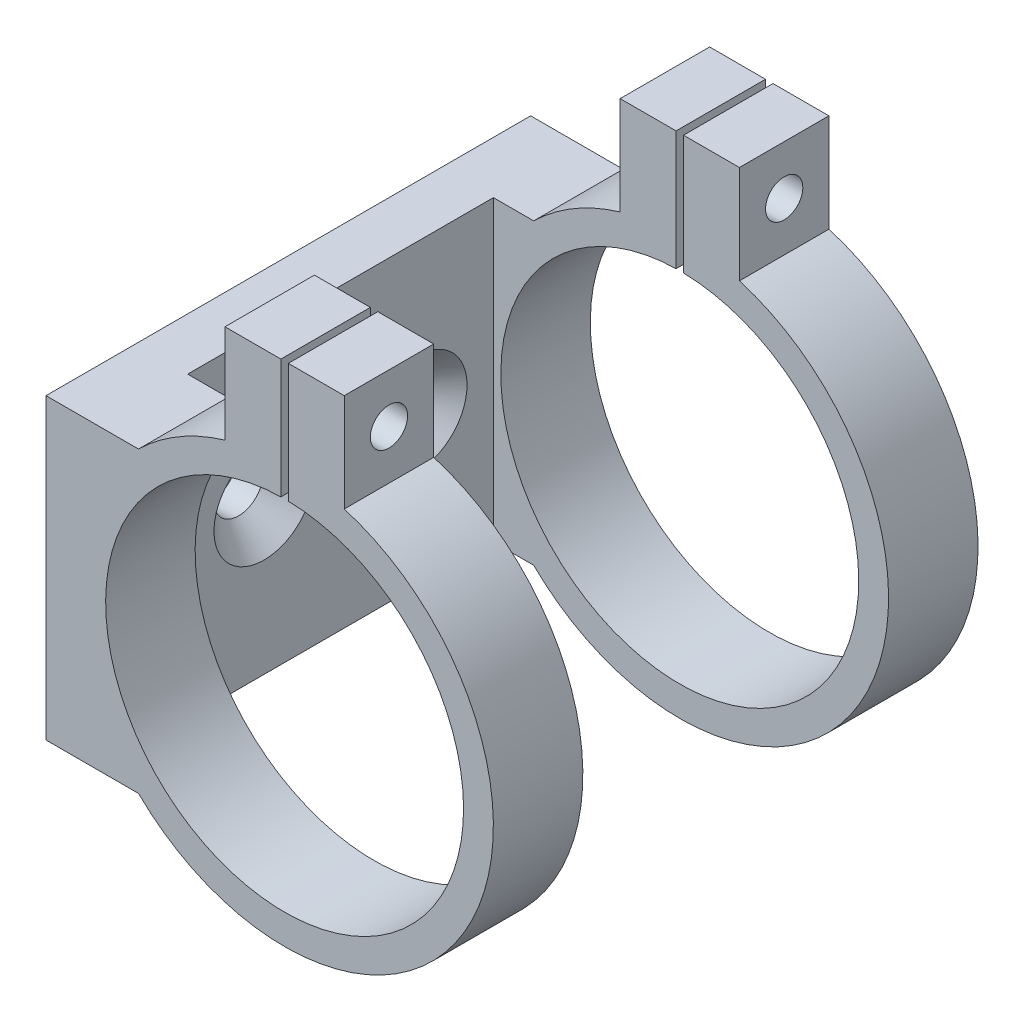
SolidWorks part; units mm, degrees
ref_plane "Front Plane" through (0, 0, 0) normal (0, 0, 1) x (1, 0, 0)
ref_plane "Top Plane" through (0, 0, 0) normal (0, 1, 0) x (1, 0, 0)
ref_plane "Right Plane" through (0, 0, 0) normal (1, 0, 0) x (0, 0, -1)
sketch "Sketch1" plane through (0, 0, 0) normal (0, 0, 1) x (1, 0, 0)
  line L0 (0, 0) -> (0, 56.8977) construction
  line L1 (8, 40) -> (-8, 40)
  line L2 (-8, 40) -> (-8, 26.8328)
  line L3 (8, 40) -> (8, 26.8328)
  line L4 (0, 0) -> (-62.8167, 0) construction
  line L5 (-32, -20) -> (-32, 20)
  line L6 (-32, 20) -> (-19.5959, 20)
  line L7 (-32, -20) -> (-19.5959, -20)
  line L8 (-53.7317, 28) -> (53.7317, 28) construction
  line L9 (-28, 33.8607) -> (-28, -33.8607) construction
  circle A0 centre (0, 0) radius 24
  circle A1 centre (0, 0) radius 28
  point P11 (0, 40)
  point P17 (-32, 0)
  point P21 (0, 28)
  point P23 (-28, 0)
  dimension "D2" = 48
  dimension "D5" = 4
  dimension "D3" = 8
  dimension "D4" = 12
  dimension "D6" = 40
  dimension "D1" = 4
extrude "Boss-Extrude1" add sketch "Sketch1" along normal mid plane 65 contours A1 L3 L1 L2 | A1 A0 | A1 L6 L5 | A1 L5 L7
ref_plane "Plane1" through (-25, 0, 0) normal (-1, 0, 0) x (0, 0, 1)
sketch "Sketch2" plane through (-25, 0, 0) normal (-1, 0, 0) x (0, 0, 1)
  line L0 (0, 60.0935) -> (0, -60.0935) construction
  line L1 (-20.5, 40) -> (-20.5, -28.6785)
  line L2 (32.5, 40) -> (-32.5, 40) construction
  line L3 (-20.5, -28.6785) -> (20.5, -28.6785)
  line L4 (20.5, -28.6785) -> (20.5, 40)
  line L5 (20.5, 40) -> (-20.5, 40)
  line L6 (-32.5, 40) -> (-32.5, 26.8328) construction
  line L7 (32.5, 40) -> (32.5, 26.8328) construction
  point P4 (0, 0)
  dimension "D1" = 12
  dimension "D2" = 12
extrude "Cut-Extrude1" cut sketch "Sketch2" against normal through all
sketch "Sketch3" plane through (0, 0, 32.5) normal (0, 0, 1) x (1, 0, 0)
  line L0 (0, 40) -> (0, 24) construction
  line L1 (8, 40) -> (-8, 40) construction
  line L3 (-0.5, 16.7683) -> (0.5, 16.7683)
  line L4 (-0.5, 16.7683) -> (-0.5, 47.2317)
  line L5 (-0.5, 47.2317) -> (0.5, 47.2317)
  line L6 (0.5, 16.7683) -> (0.5, 47.2317)
  line L7 (-0.5, 16.7683) -> (0.5, 47.2317) construction
  line L8 (-0.5, 47.2317) -> (0.5, 16.7683) construction
  circle A0 centre (0, 0) radius 24 construction
  point P7 (0, 32)
  dimension "D1" = 1
extrude "Cut-Extrude2" cut sketch "Sketch3" against normal up to surface (65 mm away)
sketch "Sketch4" plane through (8, 0, 0) normal (1, 0, 0) x (0, 0, -1)
  line L0 (20.5, 33.4164) -> (32.5, 33.4164) construction
  line L1 (20.5, 26.8328) -> (20.5, 40) construction
  line L2 (32.5, 40) -> (32.5, 26.8328) construction
  line L3 (-20.5, 33.4164) -> (-32.5, 33.4164) construction
  line L4 (-20.5, 40) -> (-20.5, 26.8328) construction
  line L5 (-32.5, 40) -> (-32.5, 26.8328) construction
  circle A0 centre (26.5, 33.4164) radius 2.5
  circle A1 centre (-26.5, 33.4164) radius 2.5
  dimension "D1" = 5
extrude "Cut-Extrude3" cut sketch "Sketch4" against normal up to surface (16 mm away)
sketch "Sketch8" plane through (-25, 0, 0) normal (1, 0, 0) x (0, 0, -1)
  line L0 (0, -20) -> (0, 20) construction
  line L1 (20.5, -20) -> (-20.5, -20) construction
  line L2 (20.5, 20) -> (-20.5, 20) construction
  line L3 (0, 0) -> (-20.5, 0) construction
  line L4 (-20.5, -20) -> (-20.5, 20) construction
  line L5 (0, 0) -> (20.5, 0) construction
  line L6 (20.5, 20) -> (20.5, -20) construction
  circle A0 centre (-10.25, 0) radius 2.9128 construction
  circle A1 centre (10.25, 0) radius 2.9128 construction
hole_wizard "CSK for M6 SFHCS1" positions "Sketch11" profile "Sketch12" countersink size "M6" standard "ANSI Metric"
sketch "Sketch11" plane through (-25, 0, 0) normal (1, 0, 0) x (0, 0, -1)
  point P0 (-10.25, 0)
  point P3 (10.25, 0)
sketch "Sketch12" plane through (-25, 0, 10.25) normal (0, 1, 0) x (0, 0, -1)
  line L0 (0, 0) -> (0, 7)
  line L1 (0, 7) -> (3.3, 7)
  line L2 (3.3, 7) -> (3.3, 3.42)
  line L3 (3.3, 3.42) -> (6.72, 0)
  line L5 (6.72, 0) -> (0, 0)
  line L6 (-3.3, 3.42) -> (-6.72, 0) construction
  line L11 (0, -6.35) -> (0, 107.95) construction
  dimension "Thru Hole Dia." = 6.6
  dimension "Thru Hole Depth" = 7
  dimension "Near C'Sink Dia." = 13.44
  dimension "Near C'Sink Angle" = 90
